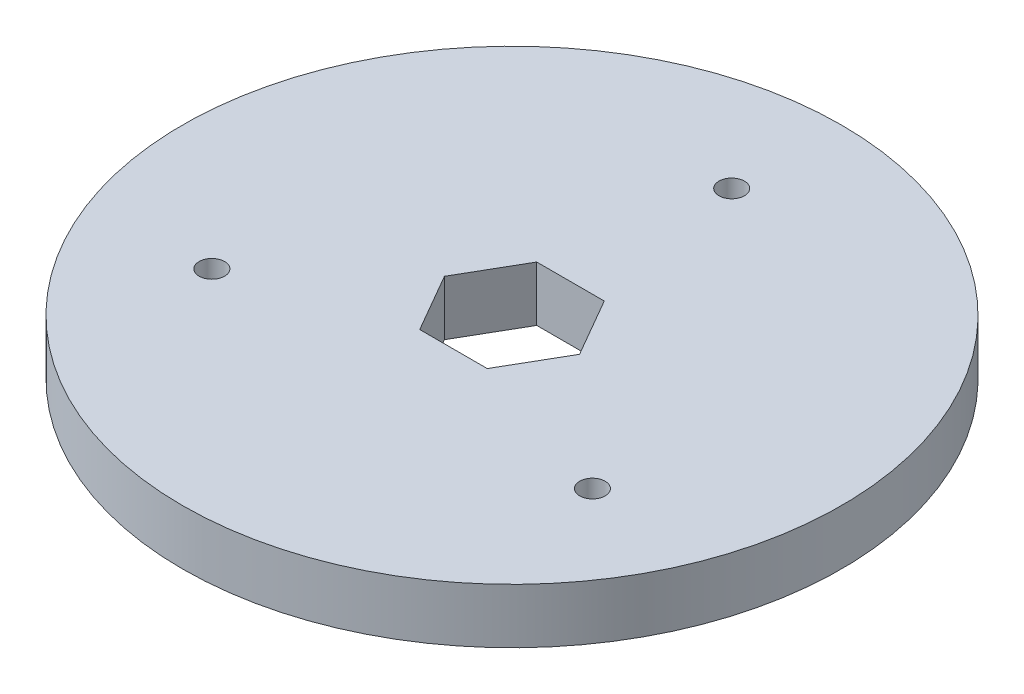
SolidWorks part; units mm, degrees
ref_plane "Front Plane" through (0, 0, 0) normal (0, 0, 1) x (1, 0, 0)
ref_plane "Top Plane" through (0, 0, 0) normal (0, 1, 0) x (1, 0, 0)
ref_plane "Right Plane" through (0, 0, 0) normal (1, 0, 0) x (0, 0, -1)
sketch "Sketch1" plane through (0, 0, 0) normal (0, 1, 0) x (1, 0, 0)
  line L1 (7.809, 0) -> (3.9045, 6.7627)
  line L2 (3.9045, 6.7627) -> (-3.9045, 6.7627)
  line L3 (-3.9045, 6.7627) -> (-7.809, 0)
  line L4 (-7.809, 0) -> (-3.9045, -6.7628)
  line L5 (-3.9045, -6.7628) -> (3.9045, -6.7628)
  line L6 (3.9045, -6.7628) -> (7.809, 0)
  circle A0 centre (0, 0) radius 38.1
  circle A1 centre (0, 25.4) radius 1.4732
  circle A2 centre (0, 0) radius 25.4 construction
  circle A3 centre (21.997, -12.7) radius 1.4732
  circle A4 centre (-21.997, -12.7) radius 1.4732
  circle A5 centre (0, 0) radius 4.191 construction
  circle A6 centre (0, 0) radius 6.7627 construction
  point P13 (0, 0)
  dimension "D1" = 76.2
  dimension "D2" = 50.8
  dimension "D3" = 2.9464
  dimension "D5" = 8.382
  dimension "D6" = 13.5255
  dimension "D4" = 3
extrude "Boss-Extrude1" add sketch "Sketch1" along normal blind 6.35
